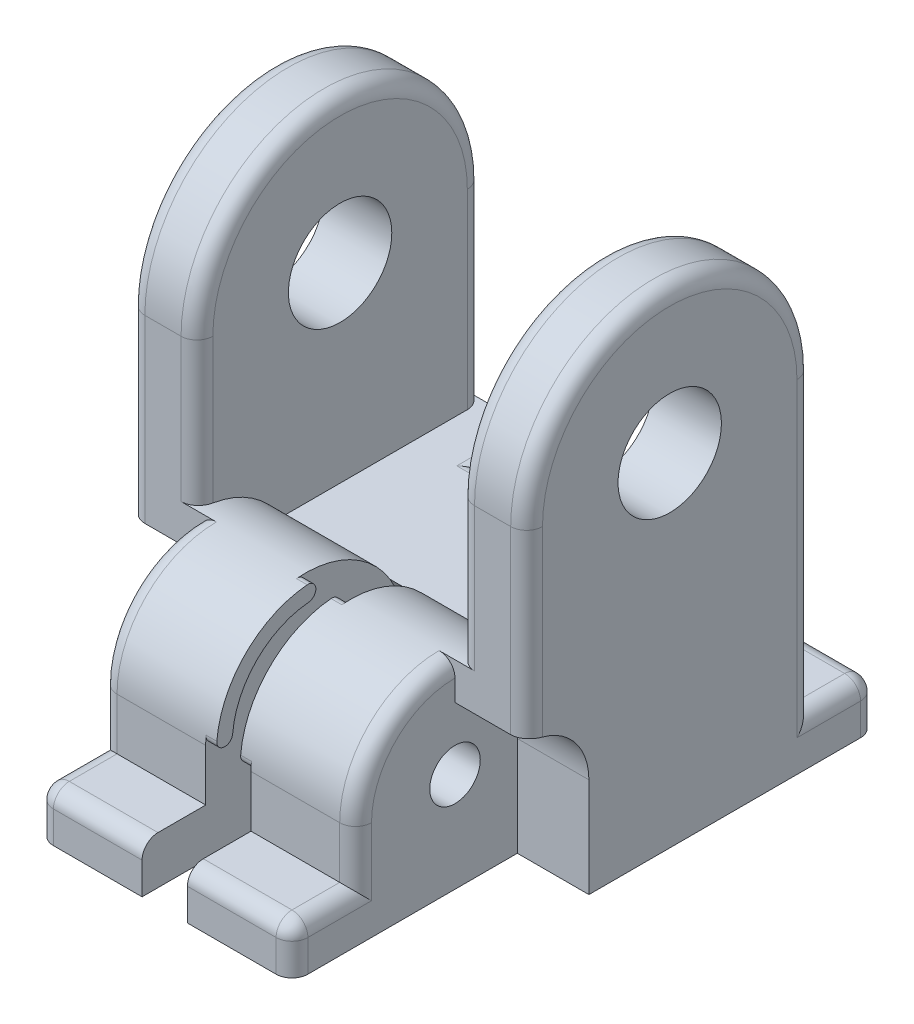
SolidWorks part; units mm, degrees
ref_plane "Front Plane" through (0, 0, 0) normal (0, 0, 1) x (1, 0, 0)
ref_plane "Top Plane" through (0, 0, 0) normal (0, 1, 0) x (1, 0, 0)
ref_plane "Right Plane" through (0, 0, 0) normal (1, 0, 0) x (0, 0, -1)
sketch "Sketch1" plane through (0, 0, 0) normal (1, 0, 0) x (0, 0, -1)
  line L0 (0, 0) -> (39.0226, 0) construction
  line L1 (0, 0) -> (0, 6.25) construction
  line L2 (-6.25, 6.25) -> (-6.25, 0) construction
  line L3 (-10.25, 0) -> (22, 0)
  line L4 (-10.25, 0) -> (-10.25, 3)
  line L5 (-10.25, 3) -> (-6.25, 3)
  line L6 (-6.25, 3) -> (-6.25, 6.25)
  line L7 (-6.25, 0) -> (0, 0) construction
  line L8 (0, 12.5) -> (18.6083, 12.5) construction
  line L9 (52.3127, 6) -> (-34.6817, 6) construction
  line L10 (0, 21.5) -> (0, 12.5)
  line L12 (18, 21.5) -> (18, 3)
  line L13 (18, 3) -> (22, 3)
  line L14 (22, 3) -> (22, 0)
  line L15 (-4.75, 6.25) -> (-4.75, 26.7415) construction
  circle A0 centre (0, 6.25) radius 1.5875
  circle A1 centre (0, 6.25) radius 4.75 construction
  circle A2 centre (0, 6.25) radius 6.25 construction
  circle A3 centre (9, 21.5) radius 9 construction
  circle A4 centre (9, 21.5) radius 3.25
  arc A5 (18, 21.5) -> (0, 21.5) centre (9, 21.5) ccw
  arc A6 (-6.25, 6.25) -> (0, 12.5) centre (0, 6.25) cw
  dimension "D1" = 3.175
  dimension "D2" = 9.5
  dimension "D3" = 12.5
  dimension "D6" = 6.5
  dimension "D7" = 18
  dimension "D8" = 6
  dimension "D9" = 22.75
  dimension "D4" = 3
  dimension "D5" = 4
extrude "Main Body" add sketch "Sketch1" along normal mid plane 25
sketch "Sketch2" plane through (0, 0, 0) normal (1, 0, 0) x (0, 0, -1)
  line L0 (-6.25, 6.25) -> (-6.25, 3) construction
  line L1 (-6.25, 3) -> (-10.25, 3) construction
  line L2 (-10.25, 3) -> (-10.25, 0) construction
  line L3 (-10.25, 0) -> (22, 0) construction
  line L4 (-6.25, 6.25) -> (-6.25, 3)
  line L5 (-6.25, 3) -> (-10.25, 3)
  line L6 (-10.25, 3) -> (-10.25, 0)
  line L7 (-10.25, 0) -> (6.25, 0)
  line L8 (6.25, 6.25) -> (6.25, 0)
  arc A1 (0, 12.5) -> (-6.25, 6.25) centre (0, 6.25) ccw construction
  arc A2 (0, 12.5) -> (6.25, 6.25) centre (0, 6.25) cw
  arc A3 (0, 12.5) -> (-6.25, 6.25) centre (0, 6.25) ccw
extrude "Pulley Clearance" cut sketch "Sketch2" against normal mid plane 2.4
sketch "Sketch3" plane through (0, 0, 0) normal (1, 0, 0) x (0, 0, -1)
  line L1 (0, 21.5) -> (0, 12.5) construction
  line L2 (0, 21.5) -> (0, 12.5)
  line L5 (18, 3) -> (18, 21.5) construction
  line L6 (18, 9.5) -> (18, 21.5)
  line L7 (5.3385, 9.5) -> (18, 9.5)
  circle A0 centre (0, 6.25) radius 4.75 construction
  arc A1 (18, 21.5) -> (0, 21.5) centre (9, 21.5) ccw construction
  arc A2 (18, 21.5) -> (0, 21.5) centre (9, 21.5) ccw
  arc A3 (0, 12.5) -> (5.3385, 9.5) centre (0, 6.25) cw
  dimension "D1" = 9.5
  dimension "D2" = 3
extrude "Finger Clearance" cut sketch "Sketch3" against normal mid plane 16
sketch "Sketch7" plane through (12.5, 0, 0) normal (1, 0, 0) x (0, 0, -1)
  line L0 (-6.25, 6.25) -> (-6.25, 3) construction
  line L1 (-6.25, 3) -> (-10.25, 3) construction
  line L2 (-10.25, 3) -> (-10.25, 0) construction
  line L3 (-6.25, 6.25) -> (-6.25, 3)
  line L4 (-6.25, 3) -> (-10.25, 3)
  line L5 (-10.25, 3) -> (-10.25, 0)
  line L6 (0, 12.5) -> (0, 0)
  line L7 (0, 0) -> (-10.25, 0)
  line L8 (-6.25, 6.25) -> (6.25, 6.25) construction
  arc A0 (0, 12.5) -> (-6.25, 6.25) centre (0, 6.25) ccw construction
  arc A1 (0, 12.5) -> (-6.25, 6.25) centre (0, 6.25) ccw
extrude "Side Clearance 1" cut sketch "Sketch7" against normal up to surface (4.5 mm away)
sketch "Sketch8" plane through (-12.5, 0, 0) normal (-1, 0, 0) x (0, 0, 1)
  line L0 (6.25, 6.25) -> (6.25, 3) construction
  line L1 (6.25, 3) -> (10.25, 3) construction
  line L2 (10.25, 3) -> (10.25, 0) construction
  line L3 (6.25, 6.25) -> (6.25, 3)
  line L4 (6.25, 3) -> (10.25, 3)
  line L5 (10.25, 3) -> (10.25, 0)
  line L6 (0, 12.5) -> (0, 0)
  line L7 (0, 0) -> (10.25, 0)
  arc A0 (6.25, 6.25) -> (0, 12.5) centre (0, 6.25) ccw construction
  arc A1 (6.25, 6.25) -> (0, 12.5) centre (0, 6.25) ccw
extrude "Side Clearance 2" cut sketch "Sketch8" against normal up to surface (4.5 mm away)
sketch "Sketch9" plane through (8, 0, 0) normal (1, 0, 0) x (0, 0, -1)
  line L0 (-3.9188, 6.25) -> (-6.25, 6.25) construction
  line L1 (0, 7.8375) -> (0, 10.1688) construction
  line L2 (3.9188, 6.25) -> (3.9188, 0)
  line L3 (3.9188, 0) -> (-3.9188, 0)
  line L4 (0, 0) -> (-10.25, 0) construction
  line L5 (-3.9188, 0) -> (-3.9188, 6.25)
  arc A0 (3.9188, 6.25) -> (-3.9188, 6.25) centre (0, 6.25) ccw
extrude "Side Pulley Clearance 1" cut sketch "Sketch9" along normal up to surface (4.5 mm away)
sketch "Sketch10" plane through (-8, 0, 0) normal (-1, 0, 0) x (0, 0, 1)
  line L0 (-3.9188, 6.25) -> (-3.9188, 0)
  line L1 (-3.9188, 0) -> (3.9188, 0)
  line L2 (0, 0) -> (10.25, 0) construction
  line L3 (3.9188, 0) -> (3.9188, 6.25)
  arc A0 (3.9188, 6.25) -> (-3.9188, 6.25) centre (0, 6.25) ccw
  arc A1 (0, 10.1688) -> (-3.9188, 6.25) centre (0, 6.25) ccw construction
extrude "Side Pulley Clearance 2" cut sketch "Sketch10" along normal up to surface (4.5 mm away)
sketch "Sketch12" plane through (0, 0, 0) normal (1, 0, 0) x (0, 0, -1)
  line L0 (-6.25, 6.25) -> (-5.25, 6.25)
  line L1 (0, 12.5) -> (0, 11.5)
  arc A0 (0, 12.5) -> (-6.25, 6.25) centre (0, 6.25) ccw
  arc A1 (5.3385, 9.5) -> (-6.25, 6.25) centre (0, 6.25) ccw construction
  arc A2 (0, 11.5) -> (-5.25, 6.25) centre (0, 6.25) ccw
  dimension "D1" = 1
extrude "Pully Cover" add sketch "Sketch12" along normal up to surface and the other way up to surface
sketch "Sketch13" plane through (0, 0, 0) normal (0, -1, 0) x (1, 0, 0)
  line L0 (0, 0) -> (0, -6.25) construction
  line L1 (-1.2, -6.25) -> (1.2, -6.25) construction
  line L3 (0.75, 0) -> (-0.75, 0)
  line L4 (0.75, 0) -> (0.75, 10.25)
  line L5 (0.75, 10.25) -> (-0.75, 10.25)
  line L6 (-0.75, 0) -> (-0.75, 10.25)
  dimension "D1" = 1.5
extrude "Pully Cover Cutaway" cut sketch "Sketch13" against normal through all
sketch "Sketch15" plane through (0, 0, -18) normal (0, 0, -1) x (-1, 0, 0)
  line L0 (0, 0) -> (0, 9.5) construction
  line L1 (8, 9.5) -> (-8, 9.5) construction
  line L3 (4.5, 9.5) -> (3, 9.5)
  line L4 (4.5, 9.5) -> (4.5, 6)
  line L5 (4.5, 6) -> (3, 6)
  line L6 (3, 9.5) -> (3, 6)
  dimension "D1" = 6
  dimension "D2" = 3
  dimension "D3" = 1.5
revolve "Torsion Spring Notches" cut sketch "Sketch15" angle 360 about axis through (-8, 9.5, -18) along (1, 0, 0)
sketch "Sketch16" plane through (0, 0, 0) normal (1, 0, 0) x (0, 0, -1)
  line L0 (0, 21.5) -> (0, 12.5) construction
  line L1 (18, 9.5) -> (18, 21.5) construction
  line L2 (5.3385, 9.5) -> (18, 9.5) construction
  line L3 (0, 21.5) -> (0, 12.5)
  line L4 (18, 9.5) -> (18, 21.5)
  line L5 (5.3385, 9.5) -> (18, 9.5)
  arc A0 (5.3385, 9.5) -> (0, 12.5) centre (0, 6.25) ccw construction
  arc A1 (18, 21.5) -> (0, 21.5) centre (9, 21.5) ccw construction
  arc A2 (5.3385, 9.5) -> (0, 12.5) centre (0, 6.25) ccw
  arc A3 (18, 21.5) -> (0, 21.5) centre (9, 21.5) ccw
extrude "Print Finger Clearance" cut sketch "Sketch16" against normal mid plane 16.45
sketch "Sketch17" plane through (0, 0, 0) normal (1, 0, 0) x (0, 0, -1)
  line L0 (-10.25, 0) -> (6.25, 0) construction
  line L1 (-10.25, 3) -> (-10.25, 0) construction
  line L2 (-6.25, 3) -> (-10.25, 3) construction
  line L3 (-6.25, 6.25) -> (-6.25, 3) construction
  line L4 (6.25, 0) -> (6.25, 6.25) construction
  line L5 (-5.25, 6.25) -> (-6.25, 6.25) construction
  line L6 (0, 12.5) -> (0, 11.5) construction
  line L7 (-10.25, 0) -> (6.25, 0)
  line L8 (-10.25, 3) -> (-10.25, 0)
  line L9 (-6.25, 3) -> (-10.25, 3)
  line L10 (-6.25, 6.25) -> (-6.25, 3)
  line L11 (6.25, 0) -> (6.25, 6.25)
  line L12 (-5.25, 6.25) -> (-6.25, 6.25)
  line L13 (0, 12.5) -> (0, 11.5)
  arc A0 (5.3385, 9.5) -> (0, 12.5) centre (0, 6.25) ccw construction
  arc A1 (6.25, 6.25) -> (5.3385, 9.5) centre (0, 6.25) ccw construction
  arc A2 (0, 11.5) -> (-5.25, 6.25) centre (0, 6.25) ccw construction
  arc A3 (5.3385, 9.5) -> (0, 12.5) centre (0, 6.25) ccw
  arc A4 (6.25, 6.25) -> (5.3385, 9.5) centre (0, 6.25) ccw
  arc A5 (0, 11.5) -> (-5.25, 6.25) centre (0, 6.25) ccw
extrude "Print Pulley Clearance" cut sketch "Sketch17" against normal mid plane 2.85
fillet "Pulley Cover Fillet" radius 0.5 6 edges at (1.0875, 11.5, 0) (1.0875, 12.5, 0) (-1.0875, 11.5, 0) (1.0875, 6.25, 5.25) (1.0875, 6.25, 6.25) (-1.0875, 6.25, 5.25)
fillet "Contouring" radius 1 33 edges at (-12.5, 12.25, -18) (8, 1.5, 10.25) (8, 3, 8.25) (8, 4.625, 6.25) (8, 10.6694, 4.4194) (-12.5, 3, -20) (-12.5, 1.5, -22) (-8, 1.5, 10.25) (-8, 3, 8.25) (-8, 4.625, 6.25) (-8, 10.6694, 4.4194) (0, 3, -22) (12.5, 1.5, -22) (12.5, 3, -20) (-3, 9.5, -16.25) (-3.75, 9.5, -14.5) (-4.5, 9.5, -16.25) (-4.5, 7.75, -18) (-3.75, 6, -18) (-3, 7.75, -18) (-8.225, 17, 0) (-8.225, 30.5, -9) (-8.225, 15.5, -18) (8.225, 15.5, -18) (8.225, 30.5, -9) (8.225, 17, 0) (12.5, 12.25, -18) (-4.7125, 3, 10.25) (12.5, 30.5, -9) (12.5, 15.8344, 0) (-12.5, 15.8344, 0) (4.7125, 3, 10.25) (-12.5, 30.5, -9)
ref_point "Ref Center"
equation "\"D1@Sketch1\"=\"pin diameter@values@params.sldprt\""
equation "\"D2@Sketch1\"=\"pulley diameter@values@params.sldprt\""
equation "\"D3@Sketch1\"=\"pulley diameter@values@params.sldprt\"+\"width keep@values@params.sldprt\""
equation "\"D7@Sketch1\" = \"finger height@values@params.sldprt\""
equation "\"D4@Sketch1\"=\"width keep@values@params.sldprt\""
equation "\"D5@Sketch1\"=\"width tab@values@params.sldprt\""
equation "\"D8@Sketch1\"=2*\"width keep@values@params.sldprt\""
equation "\"D1@Pulley Clearance\"=\"pulley thickness@values@params.sldprt\""
equation "\"D1@Sketch3\"=\"pulley diameter@values@params.sldprt\""
equation "\"D1@Finger Clearance\"=\"finger depth@values@params.sldprt\""
equation "\"D2@Sketch3\"=\"width keep@values@params.sldprt\""
equation "\"D9@Sketch1\" = \"LB pivot@values@params.sldprt\""
equation "\"D1@Sketch15\" = 2 * \"width keep@values@params.sldprt\""
equation "\"D2@Sketch15\"=\"width keep@values@params.sldprt\""
equation "\"D1@Print Finger Clearance\"=\"finger depth@values@params.sldprt\"+\"print free@values@params.sldprt\""
equation "\"D1@Print Pulley Clearance\"=\"pulley thickness@values@params.sldprt\"+\"print free@values@params.sldprt\""
